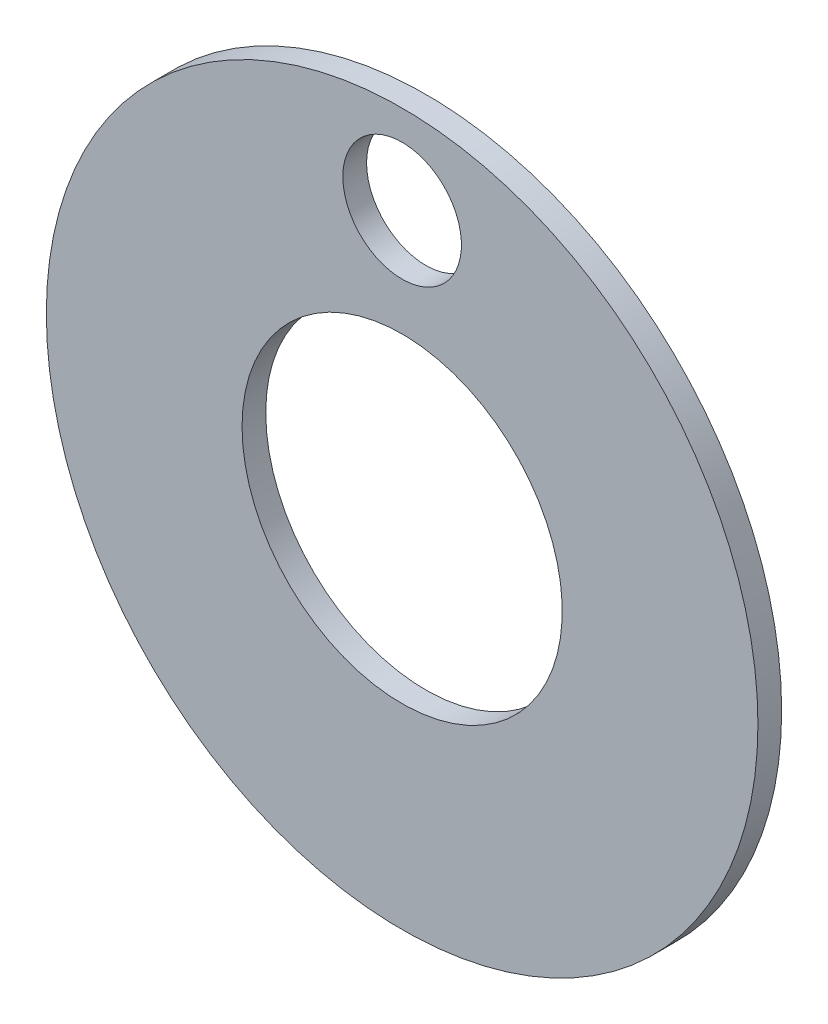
SolidWorks part; units mm, degrees
ref_plane "Plan de face" through (0, 0, 0) normal (0, 0, 1) x (1, 0, 0)
ref_plane "Plan de dessus" through (0, 0, 0) normal (0, 1, 0) x (1, 0, 0)
ref_plane "Plan de droite" through (0, 0, 0) normal (1, 0, 0) x (0, 0, -1)
ref_plane "Plan1" through (0, 0, 0.5) normal (0, 0, 1) x (1, 0, 0)
sketch "Esquisse1" plane through (0, 0, 0.5) normal (0, 0, 1) x (1, 0, 0)
  circle A0 centre (0, 0) radius 6.75
  circle A1 centre (0, 0) radius 15
  circle A2 centre (0, 11.25) radius 2.5
extrude "Boss.-Extru.1" add sketch "Esquisse1" against normal blind 1
